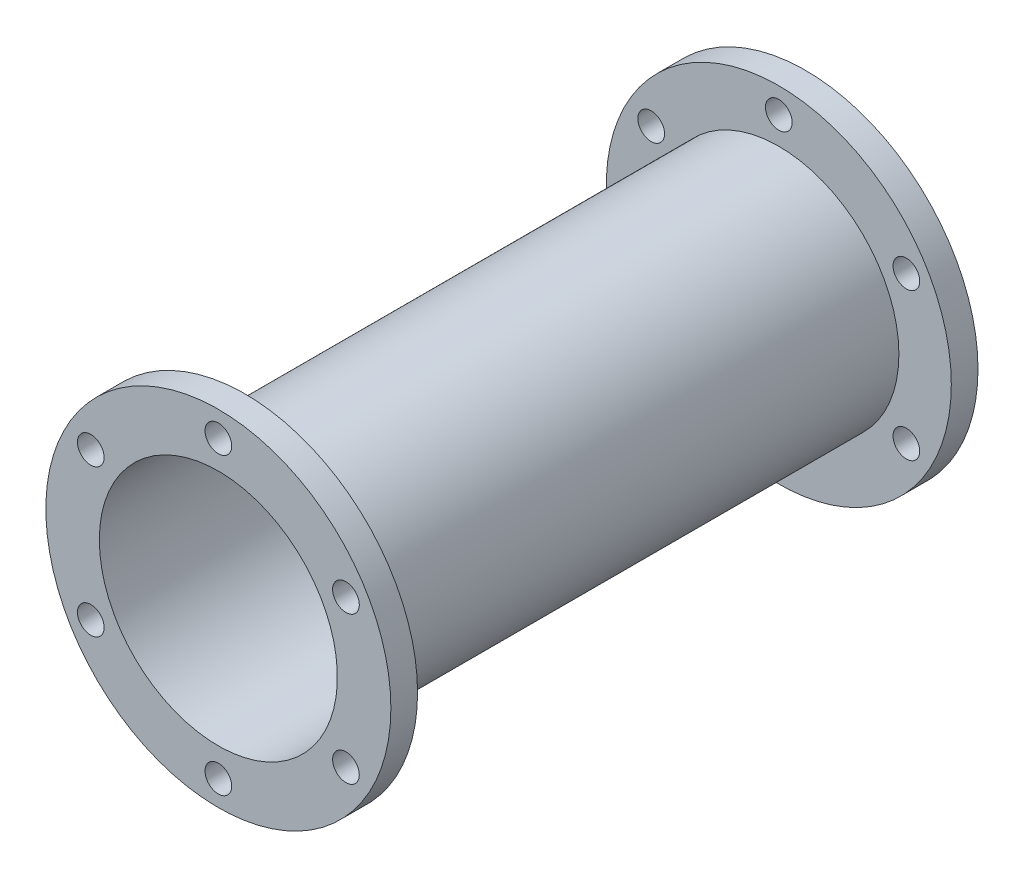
SolidWorks part; units mm, degrees
ref_plane "Front Plane" through (0, 0, 0) normal (0, 0, 1) x (1, 0, 0)
ref_plane "Top Plane" through (0, 0, 0) normal (0, 1, 0) x (1, 0, 0)
ref_plane "Right Plane" through (0, 0, 0) normal (1, 0, 0) x (0, 0, -1)
sketch "Sketch1" plane through (0, 0, 0) normal (0, 0, 1) x (1, 0, 0)
  circle A0 centre (0, 0) radius 41.0464
  dimension "D1" = 82.0928
extrude "Boss-Extrude1" add sketch "Sketch1" along normal blind 6.35
sketch "Sketch2" plane through (0, 0, 6.35) normal (0, 0, 1) x (1, 0, 0)
  circle A0 centre (0, 35.052) radius 3.175
  dimension "D1" = 6.35
  dimension "D2" = 35.052
extrude "Cut-Extrude1" cut sketch "Sketch2" against normal through all
pattern_circular "CirPattern1" count 6 over 360 about axis through (0, 0, 0) along (0, 0, 1) of "Cut-Extrude1"
sketch "Sketch3" plane through (0, 0, 6.35) normal (0, 0, 1) x (1, 0, 0)
  circle A0 centre (0, 0) radius 28.575
  dimension "D1" = 57.15
extrude "Boss-Extrude2" add sketch "Sketch3" along normal blind 127
sketch "Sketch4" plane through (0, 0, 133.35) normal (0, 0, 1) x (1, 0, 0)
  circle A0 centre (0, 0) radius 41.0464
  dimension "D1" = 82.0928
extrude "Boss-Extrude3" add sketch "Sketch4" along normal blind 6.35
sketch "Sketch6" plane through (0, 0, 0) normal (0, 0, -1) x (-1, 0, 0)
  circle A0 centre (0, 0) radius 28.321
  dimension "D1" = 56.642
extrude "Cut-Extrude5" cut sketch "Sketch6" against normal through all
sketch "Sketch8" plane through (0, 0, 139.7) normal (0, 0, 1) x (1, 0, 0)
  circle A0 centre (0, 35.052) radius 3.175
  dimension "D1" = 6.35
  dimension "D2" = 35.052
extrude "Cut-Extrude6" cut sketch "Sketch8" against normal blind 6.35
pattern_circular "CirPattern2" count 6 over 360 about axis through (0, 0, 0) along (0, 0, 1) of "Cut-Extrude6"
